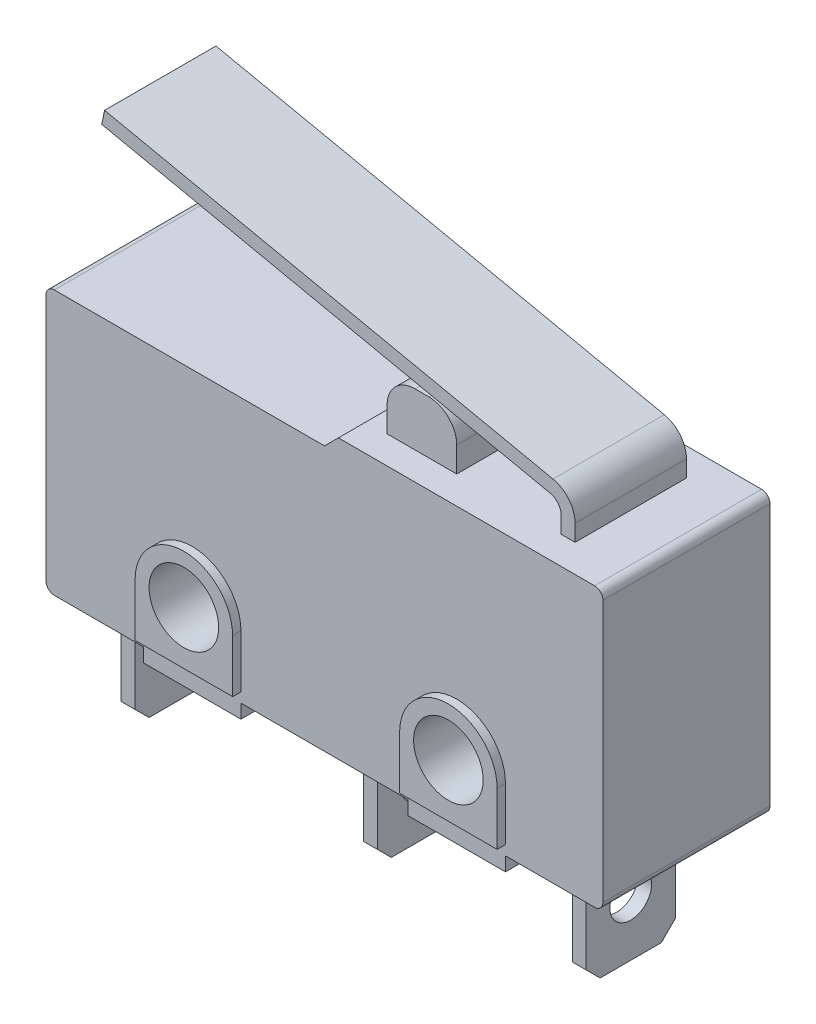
SolidWorks part; units mm, degrees
ref_plane "Спереди" through (0, 0, 0) normal (0, 0, 1) x (1, 0, 0)
ref_plane "Сверху" through (0, 0, 0) normal (0, 1, 0) x (1, 0, 0)
ref_plane "Справа" through (0, 0, 0) normal (1, 0, 0) x (0, 0, -1)
sketch "Sketch1" plane through (0, 0, 0) normal (0, 0, 1) x (1, 0, 0)
  line L1 (10, 5.25) -> (-10, 5.25)
  line L2 (10, 5.25) -> (10, -5.25)
  line L3 (10, -5.25) -> (-10, -5.25)
  line L4 (-10, 5.25) -> (-10, -5.25)
  line L5 (10, 5.25) -> (-10, -5.25) construction
  line L6 (10, -5.25) -> (-10, 5.25) construction
  point P0 (0, 0)
  dimension "D1" = 20
  dimension "D2" = 10.5
extrude "Boss-Extrude1" add sketch "Sketch1" along normal mid plane 6
sketch "Sketch2" plane through (0, 0, 0) normal (0, 0, 1) x (1, 0, 0)
  line L0 (0, 5.25) -> (0, 4.75)
  line L1 (10, 5.25) -> (-10, 5.25) construction
  line L2 (0, 4.75) -> (-10, 4.75)
  line L3 (-10, 5.25) -> (-10, -5.25) construction
  line L4 (10, -5.25) -> (10, 5.25) construction
  line L5 (0, 5.25) -> (0, -5.3036) construction
  line L8 (-10, -5.25) -> (10, -5.25) construction
  line L9 (-3, -5.25) -> (3, -5.25)
  line L10 (-3, -5.25) -> (-3, -4.75)
  line L11 (-3, -4.75) -> (3, -4.75)
  line L12 (3, -5.25) -> (3, -4.75)
  line L13 (10, -5.25) -> (10, -4.75)
  line L14 (-10, -5.25) -> (-6.5, -5.25)
  line L15 (-10, -5.25) -> (-10, -4.75)
  line L16 (-10, -4.75) -> (-6.5, -4.75)
  line L17 (-6.5, -5.25) -> (-6.5, -4.75)
  line L18 (10, -5.25) -> (6.5, -5.25)
  line L19 (6.5, -5.25) -> (6.5, -4.75)
  line L20 (10, -4.75) -> (6.5, -4.75)
  line L21 (0, 5.25) -> (-10, 5.25)
  line L22 (-10, 5.25) -> (-10, 4.75)
  point P16 (0, -4.75)
  point P22 (-6.5, -5)
  dimension "D1" = 0.5
  dimension "D2" = 10
  dimension "D3" = 6
  dimension "D4" = 0.5
  dimension "D5" = 3.5
extrude "Cut-Extrude1" cut sketch "Sketch2" against normal through all both and the other way through all
sketch "Sketch3" plane through (0, 0, 0) normal (0, 0, 1) x (1, 0, 0)
  line L1 (-10, -5.25) -> (10, -5.25) construction
  line L2 (-4.75, -5.25) -> (-4.75, 4.75) construction
  line L3 (-6.5, -5.25) -> (-3, -5.25) construction
  line L4 (-10, 4.75) -> (0, 4.75) construction
  line L5 (4.75, -5.25) -> (4.75, 5.25) construction
  line L6 (3, -5.25) -> (6.5, -5.25) construction
  line L7 (10, 5.25) -> (0, 5.25) construction
  circle A0 centre (-4.75, -2.5) radius 1.25
  circle A1 centre (4.75, -2.5) radius 1.25
  point P4 (0, 0)
  dimension "D1" = 12
  dimension "D2" = 4
extrude "Cut-Extrude2" cut sketch "Sketch3" against normal through all both and the other way through all
sketch "Sketch4" plane through (0, -4.75, 0) normal (0, -1, 0) x (1, 0, 0)
  line L0 (-10, 0) -> (10, 0) construction
  line L1 (-10, -3) -> (-10, 3) construction
  line L2 (10, -3) -> (10, 3) construction
  line L3 (-8.2, 1.6) -> (-8.2, -1.6)
  line L4 (0.5, 1.6) -> (0.5, -1.6)
  line L5 (8, 1.6) -> (8, -1.6)
  point P9 (-8.2, 0)
  point P12 (0.5, 0)
  point P15 (8, 0)
  dimension "D1" = 3.2
  dimension "D2" = 10.5
  dimension "D3" = 2
  dimension "D4" = 1.8
extrude "Extrude-Thin1" add sketch "Sketch4" along normal blind 4 thin
chamfer "Chamfer1" distance 0.5 angle 45 6 edges at (-8.45, -8.75, 1.6) (-8.45, -8.75, -1.6) (7.75, -8.75, -1.6) (7.75, -8.75, 1.6) (0.25, -8.75, 1.6) (0.25, -8.75, -1.6)
sketch "Sketch5" plane through (0, 0, 0) normal (1, 0, 0) x (0, 0, -1)
  line L0 (0, -4.75) -> (0, -8.75) construction
  line L1 (3, -4.75) -> (-3, -4.75) construction
  line L2 (-1.1, -8.75) -> (1.1, -8.75) construction
  line L3 (-1.6, -4.75) -> (1.6, -4.75) construction
  circle A0 centre (0, -6.75) radius 0.75
  point P8 (0, -4.75)
  point P11 (0, 0)
  point P12 (0, -6.75)
  dimension "D1" = 1.5
extrude "Cut-Extrude3" cut sketch "Sketch5" along normal through all both and the other way through all
chamfer "Chamfer2" distance 0.5 angle 45 1 edges at (0, 5.25, 0)
fillet "Fillet1" radius 0.3 4 edges at (-10, -4.75, 0) (10, -4.75, 0) (10, 5.25, 0) (-10, 4.75, 0)
sketch "Sketch6" plane through (0, 0, 3) normal (0, 0, 1) x (1, 0, 0)
  line L0 (-6.5, -2.5) -> (-6.5, -4.4)
  line L1 (-6.5, -4.4) -> (-3, -4.4)
  line L2 (-3, -4.4) -> (-3, -2.5)
  line L3 (0, 0) -> (0, -4.6325) construction
  line L4 (3, -4.4) -> (3, -2.5)
  line L5 (6.5, -4.4) -> (3, -4.4)
  line L6 (6.5, -2.5) -> (6.5, -4.4)
  arc A0 (-3, -2.5) -> (-6.5, -2.5) centre (-4.75, -2.5) ccw
  circle A2 centre (-4.75, -2.5) radius 1.25 construction
  circle A3 centre (-4.75, -2.5) radius 1.25
  arc A4 (3, -2.5) -> (6.5, -2.5) centre (4.75, -2.5) cw
  circle A5 centre (4.75, -2.5) radius 1.25
  dimension "D1" = 0.5
  dimension "D2" = 1.9
extrude "Boss-Extrude2" add sketch "Sketch6" along normal blind 0.3
mirror "Mirror1" about plane through (0, 0, 0) normal (0, 0, 1) of "Boss-Extrude2"
sketch "Sketch7" plane through (0, 0, 0) normal (0, 0, 1) x (1, 0, 0)
  line L0 (7.5, 5.25) -> (7.5, 5.8449)
  line L1 (9.7, 5.25) -> (0.5, 5.25) construction
  line L2 (7.1038, 6.3341) -> (-9, 9.75)
  line L3 (-9.7, 4.75) -> (0, 4.75) construction
  line L4 (10, -4.45) -> (10, 4.95) construction
  line L5 (-10, 4.45) -> (-10, -4.45) construction
  arc A0 (7.5, 5.8449) -> (7.1038, 6.3341) centre (7, 5.8449) ccw
  point P9 (7.5, 6.2841)
  point P14 (7.5, 6.25)
  dimension "D5" = 0.5
  dimension "D1" = 5
  dimension "D2" = 2.5
  dimension "D3" = 1
  dimension "D4" = 1
extrude "Extrude-Thin2" add sketch "Sketch7" along normal mid plane 4 thin
sketch "Sketch8" plane through (0, 5.25, 0) normal (0, 1, 0) x (1, 0, 0)
  line L0 (0.5, 3) -> (0.5, -3) construction
  line L1 (1.25, 2) -> (3.75, 2)
  line L2 (1.25, 2) -> (1.25, -2)
  line L3 (1.25, -2) -> (3.75, -2)
  line L4 (3.75, 2) -> (3.75, -2)
  line L5 (1.25, 2) -> (3.75, -2) construction
  line L6 (1.25, -2) -> (3.75, 2) construction
  point P0 (2.5, 0)
  point P5 (0, 0)
  point P9 (0, 0)
  dimension "D1" = 4
  dimension "D2" = 2.5
  dimension "D3" = 2
extrude "Boss-Extrude3" add sketch "Sketch8" along normal blind 1.9 separate body
fillet "Fillet2" radius 1 2 edges at (3.75, 7.15, 0) (1.25, 7.15, 0)
